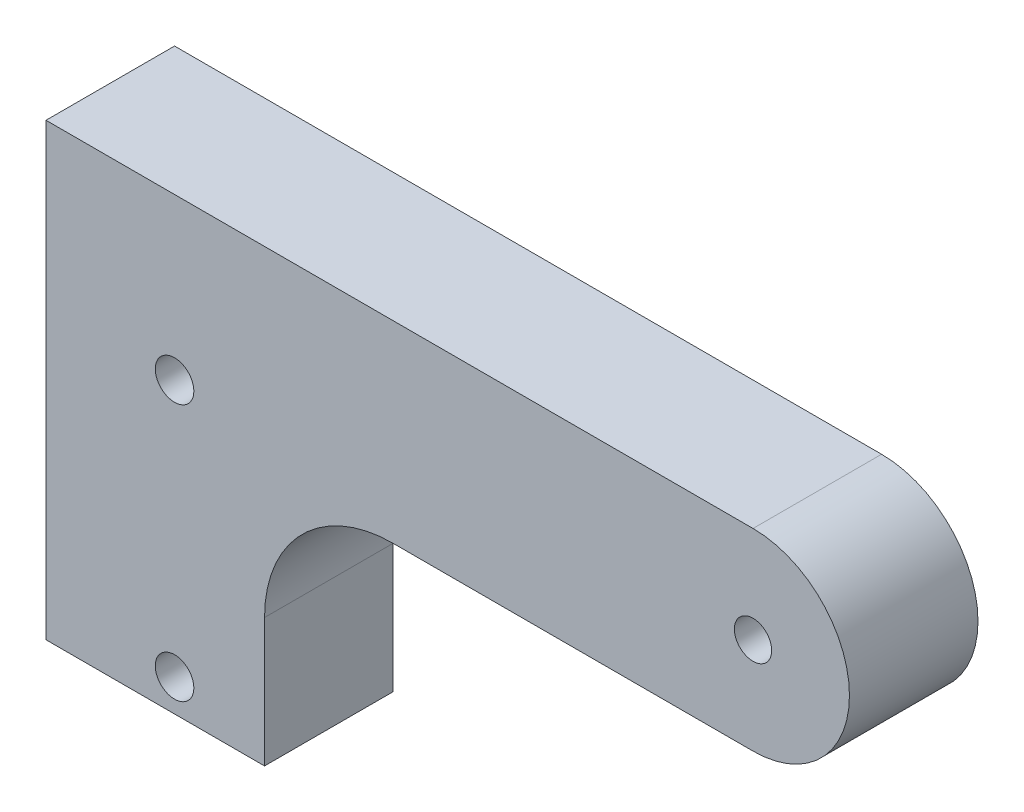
SolidWorks part; units mm, degrees
ref_plane "前视基准面" through (0, 0, 0) normal (0, 0, 1) x (1, 0, 0)
ref_plane "上视基准面" through (0, 0, 0) normal (0, 1, 0) x (1, 0, 0)
ref_plane "右视基准面" through (0, 0, 0) normal (1, 0, 0) x (0, 0, -1)
sketch "草图1" plane through (0, 0, 0) normal (0, 0, 1) x (1, 0, 0)
  line L0 (-25.5253, -15.2791) -> (-25.5253, -25.2791)
  line L1 (-25.5253, -25.2791) -> (-42.5253, -25.2791)
  line L2 (-42.5253, -25.2791) -> (-42.5253, 9.7209)
  line L5 (12.4747, 9.7209) -> (-42.5253, 9.7209)
  line L6 (-15.5253, -5.2791) -> (12.4747, -5.2791)
  arc A0 (-15.5253, -5.2791) -> (-25.5253, -15.2791) centre (-15.5253, -15.2791) ccw
  arc A1 (12.4747, -5.2791) -> (12.4747, 9.7209) centre (12.4747, 2.2209) ccw
  circle A2 centre (12.4747, 2.2209) radius 1.45
  point P9 (-25.5253, -5.2791)
  dimension "D5" = 10
  dimension "D6" = 2.9
  dimension "D1" = 15
  dimension "D2" = 38
  dimension "D3" = 35
  dimension "D4" = 17
  dimension "D7" = 15
extrude "凸台-拉伸1" add sketch "草图1" along normal blind 10
sketch "草图2" plane through (0, 0, 10) normal (0, 0, 1) x (1, 0, 0)
  line L0 (12.4747, 9.7209) -> (-42.5253, 9.7209) construction
  line L1 (-42.5253, 9.7209) -> (-42.5253, -25.2791) construction
  circle A0 centre (-32.5253, -2.7791) radius 1.5
  circle A1 centre (-32.5253, -22.7791) radius 1.5
  dimension "D1" = 3
  dimension "D2" = 12.5
  dimension "D3" = 10
  dimension "D4" = 3
  dimension "D5" = 20
  dimension "D6" = 10
extrude "切除-拉伸1" cut sketch "草图2" against normal blind 10
